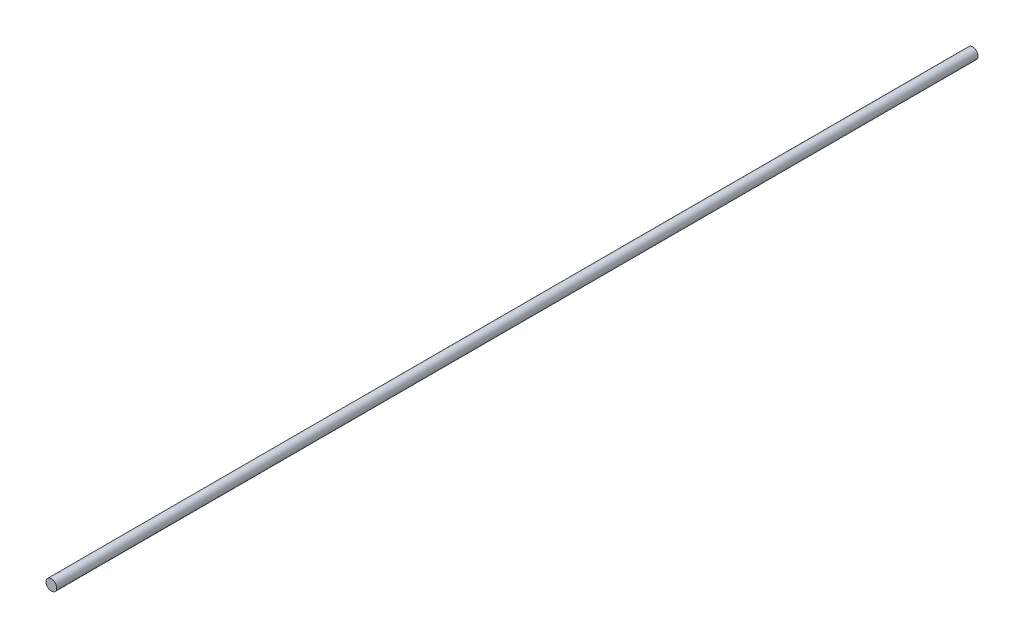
SolidWorks part; units mm, degrees
ref_plane "Front Plane" through (0, 0, 0) normal (0, 0, 1) x (1, 0, 0)
ref_plane "Top Plane" through (0, 0, 0) normal (0, 1, 0) x (1, 0, 0)
ref_plane "Right Plane" through (0, 0, 0) normal (1, 0, 0) x (0, 0, -1)
sketch "Sketch1" plane through (0, 0, 0) normal (0, 0, 1) x (1, 0, 0)
  circle A0 centre (0, 0) radius 30
  dimension "D1" = 60
extrude "Boss-Extrude1" add sketch "Sketch1" against normal blind 5150
